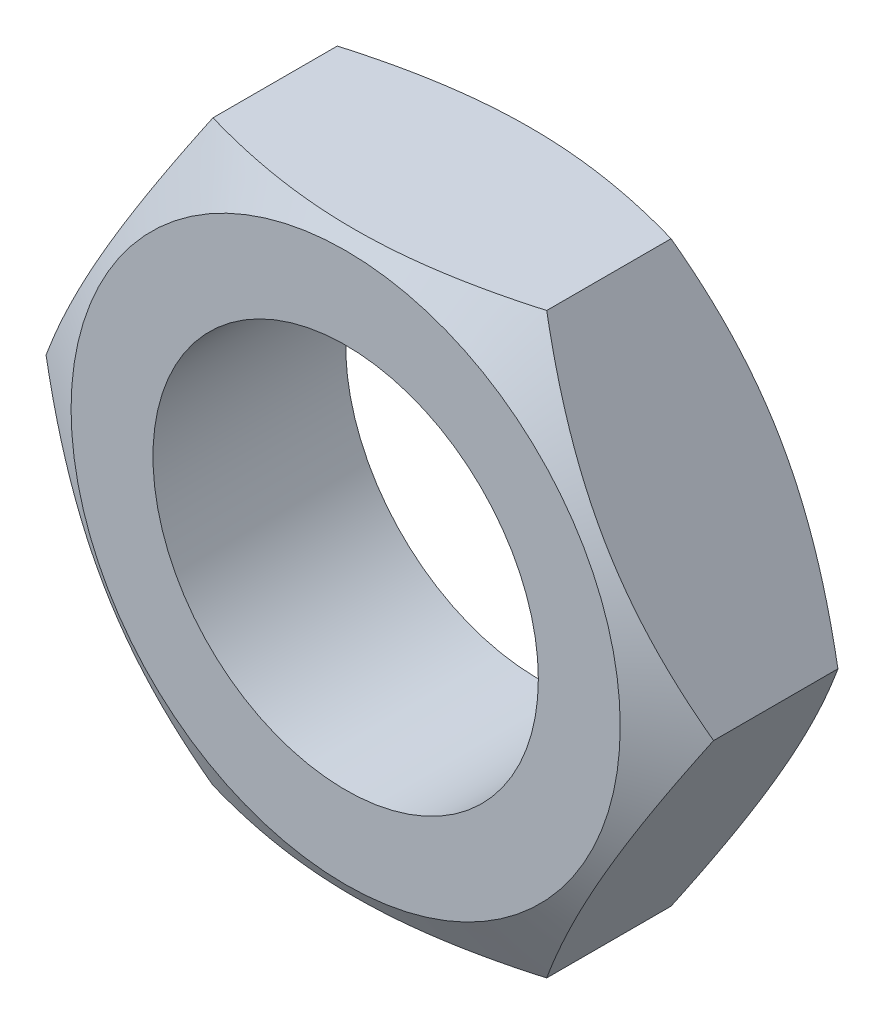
SolidWorks part; units mm, degrees
ref_plane "Plane1" through (0, 0, 0) normal (0, 0, 1) x (1, 0, 0)
ref_plane "Plane2" through (0, 0, 0) normal (0, 1, 0) x (1, 0, 0)
ref_plane "Plane3" through (0, 0, 0) normal (1, 0, 0) x (0, 0, -1)
sketch "BaseNutSke" plane through (0, 0, 0) normal (0, 0, 1) x (1, 0, 0)
  line L6 (6.9282, -12) -> (-6.9282, -12)
  line L7 (6.9282, 12) -> (-6.9282, 12)
  line L8 (6.9282, -12) -> (13.8564, 0)
  line L9 (13.8564, 0) -> (6.9282, 12)
  line L10 (-6.9282, 12) -> (-13.8564, 0)
  line L11 (-13.8564, 0) -> (-6.9282, -12)
  circle A0 centre (0, 0) radius 7 construction
  circle A1 centre (0, 0) radius 13.8564 construction
  circle A2 centre (0, 0) radius 8
  dimension "Tap_drill" = 14
  dimension "Diameter" = 16
  dimension "Width_flats" = 24
extrude "BaseNut" add sketch "BaseNutSke" against normal blind 8
ref_plane "Plane4" through (0, 0, -4) normal (0, 0, -1) x (-1, 0, 0)
sketch "Sketch6" plane through (0, 0, -8) normal (0, 0, -1) x (-1, 0, 0)
  circle A0 centre (0, 0) radius 11.4
  dimension "D1" = 22.8
extrude "Cut-Extrude2" cut sketch "Sketch6" against normal through all draft 60 flip side to cut
mirror "Mirror1" about plane through (0, 0, -4) normal (0, 0, -1) of "Cut-Extrude2"
equation "\"D1@Sketch3\" = \"Width_flats@BaseNutSke\" /2"
equation "' \"Num_threads@ThdSchPat\" = \"Num_threads@ThdSchPat\" - sgn( \"Num_threads@ThdSchPat\" - 1) '---chamfered tips only---"
equation "\"D1@Sketch6\" = 0.95 * \"Width_flats@BaseNutSke\""
